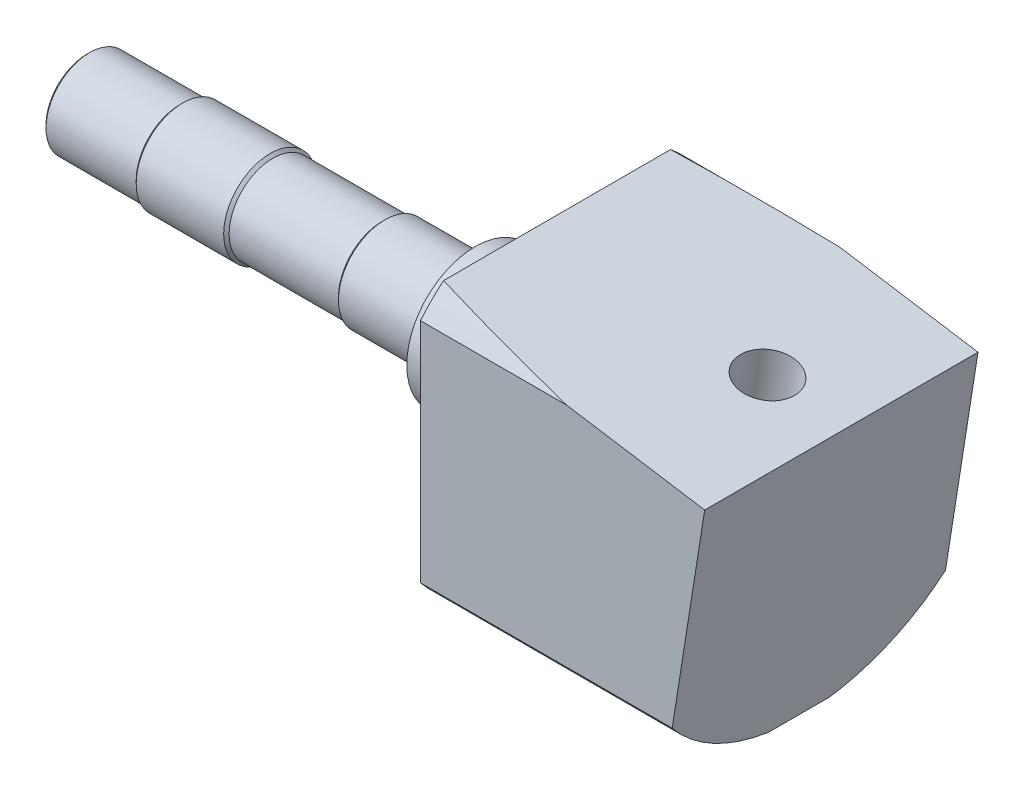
SolidWorks part; units mm, degrees
ref_plane "Face" through (0, 0, 0) normal (0, 0, 1) x (1, 0, 0)
ref_plane "Dessus" through (0, 0, 0) normal (0, 1, 0) x (1, 0, 0)
ref_plane "Droite" through (0, 0, 0) normal (1, 0, 0) x (0, 0, -1)
sketch "Esquisse1" plane through (0, 0, 0) normal (0, 0, 1) x (1, 0, 0)
  line L0 (0, 0) -> (0, 8)
  line L1 (0, 8) -> (17, 8)
  line L2 (17, 8) -> (17, 8.5)
  line L3 (17, 8.5) -> (34, 8.5)
  line L4 (34, 8.5) -> (34, 8)
  line L5 (34, 8) -> (54, 8)
  line L6 (54, 8) -> (54, 8.5)
  line L7 (54, 8.5) -> (71, 8.5)
  line L8 (71, 8.5) -> (71, 12.5)
  line L9 (71, 12.5) -> (86, 12.5)
  line L10 (86, 0) -> (86, 12.5)
  line L13 (86, 0) -> (0, 0)
  line L14 (-24.7781, 0) -> (239.1165, 0) construction
  dimension "D1" = 16
  dimension "D2" = 17
  dimension "D3" = 17
  dimension "D4" = 20
  dimension "D5" = 17
  dimension "D6" = 17
  dimension "D7" = 25
  dimension "D8" = 15
revolve "Base-Révolution" add sketch "Esquisse1" angle 360 about L14
chamfer "Chanfrein1" distance 0.5 angle 45
sketch "Esquisse7" plane through (0, 0, 0) normal (0, 0, 1) x (1, 0, 0)
  line L0 (86, 25) -> (86, -25)
  line L1 (86, -12.5) -> (86, 12.5) construction
  line L2 (71, -12.5) -> (86, -12.5) construction
  line L3 (138, 16.764) -> (130.2746, -32.0124)
  line L4 (86, 25) -> (138, 16.764)
  line L5 (86, -25) -> (130.2746, -32.0124)
  dimension "D1" = 52
  dimension "D2" = 37.5
  dimension "D3" = 50
  dimension "D4" = 81
extrude "Boss.-Extru.1" add sketch "Esquisse7" along normal mid plane 50
sketch "Esquisse8" plane through (86, 0, 0) normal (-1, 0, 0) x (0, 0, 1)
  circle A0 centre (0, 0) radius 32.5
  circle A1 centre (0, 0) radius 12.5 construction
  circle A2 centre (0, 0) radius 45
  dimension "D1" = 65
  dimension "D2" = 90
extrude "Enlèv. mat.-Extru.7" cut sketch "Esquisse8" against normal through all
sketch "Esquisse11" plane through (5.9673, 37.6759, 0) normal (0.1564, 0.9877, 0) x (-0.9877, 0.1564, 0)
  circle A0 centre (-120, 0) radius 5
  dimension "D1" = 10
  dimension "D2" = 120
extrude "Enlèv. mat.-Extru.10" cut sketch "Esquisse11" against normal through all
sketch "Esquisse12" plane through (0, 0, -25) normal (0, 0, -1) x (-1, 0, 0)
  line L1 (-86, 20.7666) -> (-86, -20.7666) construction
  circle A0 centre (-113, 9) radius 2.5
  circle A1 centre (-113, -9) radius 2.5
  dimension "D1" = 5
  dimension "D2" = 5
  dimension "D3" = 18
  dimension "D4" = 27
  dimension "D5" = 9
extrude "Enlèv. mat.-Extru.11" cut sketch "Esquisse12" against normal blind 18
